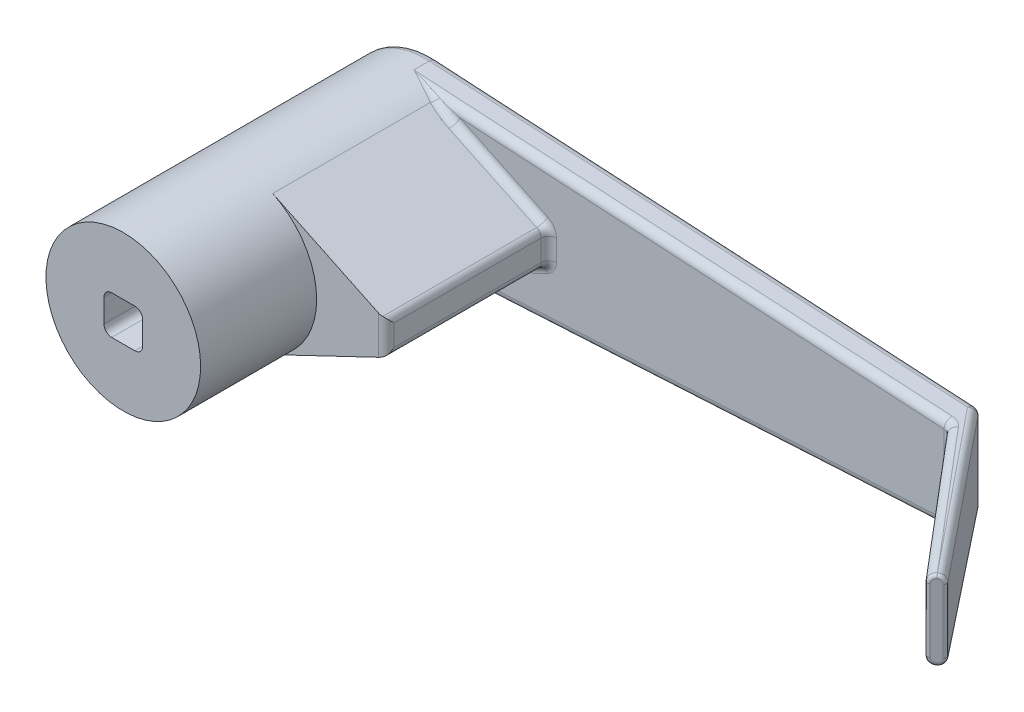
SolidWorks part; units mm, degrees
ref_plane "Front Plane" through (0, 0, 0) normal (0, 0, 1) x (1, 0, 0)
ref_plane "Top Plane" through (0, 0, 0) normal (0, 1, 0) x (1, 0, 0)
ref_plane "Right Plane" through (0, 0, 0) normal (1, 0, 0) x (0, 0, -1)
sketch "Sketch1" plane through (0, 0, 0) normal (0, 0, 1) x (1, 0, 0)
  circle A0 centre (0, 0) radius 12.7
  dimension "D1" = 25.4
extrude "Boss-Extrude1" add sketch "Sketch1" along normal blind 50.8
sketch "Sketch2" plane through (0, 0, 0) normal (0, 0, 1) x (1, 0, 0)
  line L0 (0, 0) -> (41.0392, 0) construction
  line L1 (0.7216, 12.6795) -> (89.6216, 7.62)
  line L2 (89.6216, 7.62) -> (89.6216, -7.62)
  line L3 (0.7216, -12.6795) -> (89.6216, -7.62)
  line L4 (0.7216, -12.6795) -> (0.7216, 12.6795)
  circle A0 centre (0, 0) radius 12.7 construction
  point P9 (89.6216, 0)
  dimension "D1" = 88.9
  dimension "D2" = 15.24
extrude "Boss-Extrude2" add sketch "Sketch2" along normal blind 5.08
sketch "Sketch3" plane through (0, 0, 0) normal (0, 1, 0) x (1, 0, 0)
  line L0 (89.6216, 0) -> (89.6216, -5.08)
  line L1 (89.6216, -5.08) -> (108.3399, -27.3876)
  line L2 (108.3399, -27.3876) -> (110.2857, -25.7549)
  line L3 (110.2857, -25.7549) -> (89.6216, 0)
  line L4 (89.6216, -5.08) -> (0.7216, -5.08) construction
  dimension "D1" = 33.02
  dimension "D2" = 2.54
  dimension "D3" = 130
extrude "Boss-Extrude3" add sketch "Sketch3" along normal up to surface and the other way up to surface
sketch "Sketch4" plane through (0, 0, 0) normal (0, 0, -1) x (-1, 0, 0)
  line L0 (0, 0) -> (-32.6313, 0) construction
  line L1 (-5.4781, 11.4578) -> (-24.13, 2.54)
  line L2 (-24.13, 2.54) -> (-24.13, -2.54)
  line L3 (-5.4781, 11.4578) -> (-5.4781, -11.4578)
  line L4 (-5.4781, -11.4578) -> (-24.13, -2.54)
  arc A0 (-0.7216, 12.6795) -> (-0.7216, -12.6795) centre (0, 0) ccw construction
  point P11 (-5.4781, 0)
  point P12 (-24.13, 0)
  dimension "D1" = 24.13
  dimension "D2" = 5.08
extrude "Boss-Extrude4" add sketch "Sketch4" against normal blind 31.75
sketch "Sketch5" plane through (0, 0, 50.8) normal (0, 0, 1) x (1, 0, 0)
  line L1 (-1.905, -3.175) -> (1.905, -3.175)
  line L2 (-3.175, -1.905) -> (-3.175, 1.905)
  line L3 (-1.905, 3.175) -> (1.905, 3.175)
  line L4 (3.175, -1.905) -> (3.175, 1.905)
  line L5 (-3.175, -3.175) -> (3.175, 3.175) construction
  line L6 (-3.175, 3.175) -> (3.175, -3.175) construction
  arc A0 (-1.905, -3.175) -> (-3.175, -1.905) centre (-1.905, -1.905) cw
  arc A1 (1.905, -3.175) -> (3.175, -1.905) centre (1.905, -1.905) ccw
  arc A2 (1.905, 3.175) -> (3.175, 1.905) centre (1.905, 1.905) cw
  arc A3 (-3.175, 1.905) -> (-1.905, 3.175) centre (-1.905, 1.905) cw
  point P0 (0, 0)
  dimension "D1" = 1.27
  dimension "D2" = 6.35
  dimension "D3" = 6.35
extrude "Cut-Extrude1" cut sketch "Sketch5" against normal blind 25.4
fillet "Fillet1" radius 1.27 19 edges at (-12.7, 0, 0) (98.9808, 7.0874, 16.2338) (99.9536, 7.032, 12.8775) (99.9536, -7.032, 12.8775) (98.9808, -7.0874, 16.2338) (3.1595, -12.3007, 5.08) (14.8041, 6.9989, 5.08) (24.13, 0, 5.08) (14.8041, -6.9989, 5.08) (24.13, 0, 31.75) (24.13, -2.54, 18.415) (24.13, 2.54, 18.415) (3.1595, 12.3007, 5.08) (45.1716, 10.1497, 5.08) (45.1716, -10.1497, 5.08) (89.6216, 0, 5.08) (45.1716, -10.1497, 0) (89.6216, 0, 0) (45.1716, 10.1497, 0)
fillet "Fillet4" radius 0.508 8 edges at (109.3554, -6.4969, 26.5355) (110.2857, 0, 25.7549) (108.3399, 0, 27.3876) (109.3554, 6.4969, 26.5355) (110.0157, 6.1065, 25.9814) (108.64, 6.1453, 27.1358) (110.0157, -6.1065, 25.9814) (108.64, -6.1453, 27.1358)
sketch "Sketch6" [suppressed] plane through (0, 0, 50.8) normal (0, 0, 1) x (1, 0, 0)
  line L4 (1.905, 3.175) -> (-1.905, 3.175)
  line L5 (3.175, -1.905) -> (3.175, 1.905)
  line L6 (-1.905, -3.175) -> (1.905, -3.175)
  line L7 (-3.175, 1.905) -> (-3.175, -1.905)
  line L8 (1.905, 3.175) -> (-1.905, 3.175)
  line L9 (3.175, -1.905) -> (3.175, 1.905)
  line L10 (-1.905, -3.175) -> (1.905, -3.175)
  line L11 (-3.175, 1.905) -> (-3.175, -1.905)
  arc A4 (3.175, 1.905) -> (1.905, 3.175) centre (1.905, 1.905) ccw
  arc A5 (1.905, -3.175) -> (3.175, -1.905) centre (1.905, -1.905) ccw
  arc A6 (-3.175, -1.905) -> (-1.905, -3.175) centre (-1.905, -1.905) ccw
  arc A7 (-1.905, 3.175) -> (-3.175, 1.905) centre (-1.905, 1.905) ccw
  arc A8 (3.175, 1.905) -> (1.905, 3.175) centre (1.905, 1.905) ccw
  arc A9 (1.905, -3.175) -> (3.175, -1.905) centre (1.905, -1.905) ccw
  arc A10 (-3.175, -1.905) -> (-1.905, -3.175) centre (-1.905, -1.905) ccw
  arc A11 (-1.905, 3.175) -> (-3.175, 1.905) centre (-1.905, 1.905) ccw
  dimension "D1" = 0
extrude "Boss-Extrude5" [suppressed] add sketch "Sketch6" along normal blind 76.2
fillet "Fillet5" [suppressed] radius 1.27
